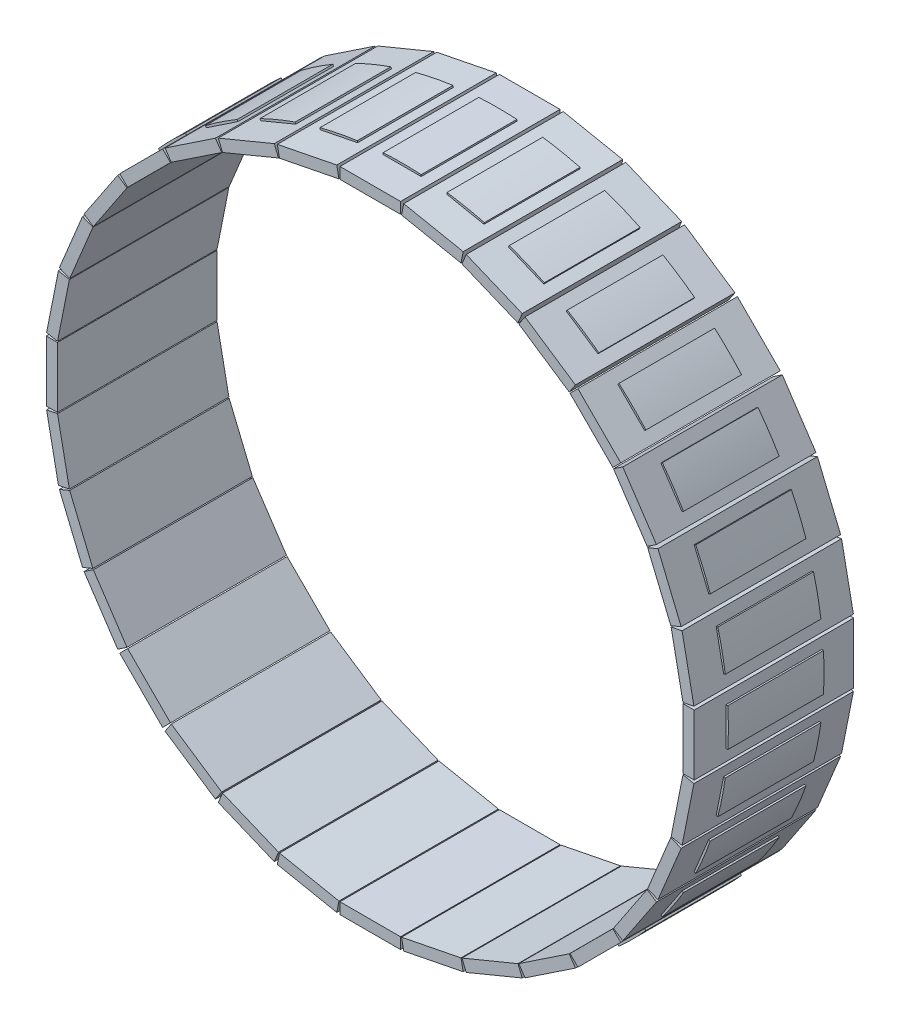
SolidWorks part; units mm, degrees
ref_plane "Спереди" through (0, 0, 0) normal (0, 0, 1) x (1, 0, 0)
ref_plane "Сверху" through (0, 0, 0) normal (0, 1, 0) x (1, 0, 0)
ref_plane "Справа" through (0, 0, 0) normal (1, 0, 0) x (0, 0, -1)
sketch "Эскиз1" plane through (0, 0, 0) normal (0, 0, 1) x (1, 0, 0)
  line L1 (-9.5, 101.5566) -> (9.5, 101.5566)
  line L2 (-9.5, 101.5566) -> (-9.5, 98.0566)
  line L3 (-9.5, 98.0566) -> (9.5, 98.0566)
  line L4 (9.5, 101.5566) -> (9.5, 98.0566)
  line L5 (0, 98.0566) -> (0, 101.5566) construction
  line L6 (-9.5, 99.8066) -> (9.5, 99.8066) construction
  line L130 (10.4953, 101.4586) -> (9.8124, 98.0259)
  line L131 (10.4953, 101.4586) -> (29.1302, 97.7519)
  line L132 (29.1302, 97.7519) -> (28.4474, 94.3191)
  line L133 (9.8124, 98.0259) -> (28.4474, 94.3191)
  line L134 (30.0872, 97.4616) -> (28.7478, 94.228)
  line L135 (30.0872, 97.4616) -> (47.6409, 90.1906)
  line L136 (47.6409, 90.1906) -> (46.3015, 86.957)
  line L137 (28.7478, 94.228) -> (46.3015, 86.957)
  line L138 (48.5229, 89.7192) -> (46.5784, 86.809)
  line L139 (48.5229, 89.7192) -> (64.3208, 79.1633)
  line L140 (64.3208, 79.1633) -> (62.3763, 76.2532)
  line L141 (46.5784, 86.809) -> (62.3763, 76.2532)
  line L142 (65.0939, 78.5289) -> (62.619, 76.054)
  line L143 (65.0939, 78.5289) -> (78.5289, 65.0939)
  line L144 (78.5289, 65.0939) -> (76.054, 62.619)
  line L145 (62.619, 76.054) -> (76.054, 62.619)
  line L146 (79.1633, 64.3208) -> (76.2532, 62.3763)
  line L147 (79.1633, 64.3208) -> (89.7192, 48.5229)
  line L148 (89.7192, 48.5229) -> (86.809, 46.5784)
  line L149 (76.2532, 62.3763) -> (86.809, 46.5784)
  line L150 (90.1906, 47.6409) -> (86.957, 46.3015)
  line L151 (90.1906, 47.6409) -> (97.4616, 30.0872)
  line L152 (97.4616, 30.0872) -> (94.228, 28.7478)
  line L153 (86.957, 46.3015) -> (94.228, 28.7478)
  line L154 (97.7519, 29.1302) -> (94.3191, 28.4474)
  line L155 (97.7519, 29.1302) -> (101.4586, 10.4953)
  line L156 (101.4586, 10.4953) -> (98.0259, 9.8124)
  line L157 (94.3191, 28.4474) -> (98.0259, 9.8124)
  line L158 (101.5566, 9.5) -> (98.0566, 9.5)
  line L159 (101.5566, 9.5) -> (101.5566, -9.5)
  line L160 (101.5566, -9.5) -> (98.0566, -9.5)
  line L161 (98.0566, 9.5) -> (98.0566, -9.5)
  line L162 (101.4586, -10.4953) -> (98.0259, -9.8124)
  line L163 (101.4586, -10.4953) -> (97.7519, -29.1302)
  line L164 (97.7519, -29.1302) -> (94.3191, -28.4474)
  line L165 (98.0259, -9.8124) -> (94.3191, -28.4474)
  line L166 (97.4616, -30.0872) -> (94.228, -28.7478)
  line L167 (97.4616, -30.0872) -> (90.1906, -47.6409)
  line L168 (90.1906, -47.6409) -> (86.957, -46.3015)
  line L169 (94.228, -28.7478) -> (86.957, -46.3015)
  line L170 (89.7192, -48.5229) -> (86.809, -46.5784)
  line L171 (89.7192, -48.5229) -> (79.1633, -64.3208)
  line L172 (79.1633, -64.3208) -> (76.2532, -62.3763)
  line L173 (86.809, -46.5784) -> (76.2532, -62.3763)
  line L174 (78.5289, -65.0939) -> (76.054, -62.619)
  line L175 (78.5289, -65.0939) -> (65.0939, -78.5289)
  line L176 (65.0939, -78.5289) -> (62.619, -76.054)
  line L177 (76.054, -62.619) -> (62.619, -76.054)
  line L178 (64.3208, -79.1633) -> (62.3763, -76.2532)
  line L179 (64.3208, -79.1633) -> (48.5229, -89.7192)
  line L180 (48.5229, -89.7192) -> (46.5784, -86.809)
  line L181 (62.3763, -76.2532) -> (46.5784, -86.809)
  line L182 (47.6409, -90.1906) -> (46.3015, -86.957)
  line L183 (47.6409, -90.1906) -> (30.0872, -97.4616)
  line L184 (30.0872, -97.4616) -> (28.7478, -94.228)
  line L185 (46.3015, -86.957) -> (28.7478, -94.228)
  line L186 (29.1302, -97.7519) -> (28.4474, -94.3191)
  line L187 (29.1302, -97.7519) -> (10.4953, -101.4586)
  line L188 (10.4953, -101.4586) -> (9.8124, -98.0259)
  line L189 (28.4474, -94.3191) -> (9.8124, -98.0259)
  line L190 (9.5, -101.5566) -> (9.5, -98.0566)
  line L191 (9.5, -101.5566) -> (-9.5, -101.5566)
  line L192 (-9.5, -101.5566) -> (-9.5, -98.0566)
  line L193 (9.5, -98.0566) -> (-9.5, -98.0566)
  line L194 (-10.4953, -101.4586) -> (-9.8124, -98.0259)
  line L195 (-10.4953, -101.4586) -> (-29.1302, -97.7519)
  line L196 (-29.1302, -97.7519) -> (-28.4474, -94.3191)
  line L197 (-9.8124, -98.0259) -> (-28.4474, -94.3191)
  line L198 (-30.0872, -97.4616) -> (-28.7478, -94.228)
  line L199 (-30.0872, -97.4616) -> (-47.6409, -90.1906)
  line L200 (-47.6409, -90.1906) -> (-46.3015, -86.957)
  line L201 (-28.7478, -94.228) -> (-46.3015, -86.957)
  line L202 (-48.5229, -89.7192) -> (-46.5784, -86.809)
  line L203 (-48.5229, -89.7192) -> (-64.3208, -79.1633)
  line L204 (-64.3208, -79.1633) -> (-62.3763, -76.2532)
  line L205 (-46.5784, -86.809) -> (-62.3763, -76.2532)
  line L206 (-65.0939, -78.5289) -> (-62.619, -76.054)
  line L207 (-65.0939, -78.5289) -> (-78.5289, -65.0939)
  line L208 (-78.5289, -65.0939) -> (-76.054, -62.619)
  line L209 (-62.619, -76.054) -> (-76.054, -62.619)
  line L210 (-79.1633, -64.3208) -> (-76.2532, -62.3763)
  line L211 (-79.1633, -64.3208) -> (-89.7192, -48.5229)
  line L212 (-89.7192, -48.5229) -> (-86.809, -46.5784)
  line L213 (-76.2532, -62.3763) -> (-86.809, -46.5784)
  line L214 (-90.1906, -47.6409) -> (-86.957, -46.3015)
  line L215 (-90.1906, -47.6409) -> (-97.4616, -30.0872)
  line L216 (-97.4616, -30.0872) -> (-94.228, -28.7478)
  line L217 (-86.957, -46.3015) -> (-94.228, -28.7478)
  line L218 (-97.7519, -29.1302) -> (-94.3191, -28.4474)
  line L219 (-97.7519, -29.1302) -> (-101.4586, -10.4953)
  line L220 (-101.4586, -10.4953) -> (-98.0259, -9.8124)
  line L221 (-94.3191, -28.4474) -> (-98.0259, -9.8124)
  line L222 (-101.5566, -9.5) -> (-98.0566, -9.5)
  line L223 (-101.5566, -9.5) -> (-101.5566, 9.5)
  line L224 (-101.5566, 9.5) -> (-98.0566, 9.5)
  line L225 (-98.0566, -9.5) -> (-98.0566, 9.5)
  line L226 (-101.4586, 10.4953) -> (-98.0259, 9.8124)
  line L227 (-101.4586, 10.4953) -> (-97.7519, 29.1302)
  line L228 (-97.7519, 29.1302) -> (-94.3191, 28.4474)
  line L229 (-98.0259, 9.8124) -> (-94.3191, 28.4474)
  line L230 (-97.4616, 30.0872) -> (-94.228, 28.7478)
  line L231 (-97.4616, 30.0872) -> (-90.1906, 47.6409)
  line L232 (-90.1906, 47.6409) -> (-86.957, 46.3015)
  line L233 (-94.228, 28.7478) -> (-86.957, 46.3015)
  line L234 (-89.7192, 48.5229) -> (-86.809, 46.5784)
  line L235 (-89.7192, 48.5229) -> (-79.1633, 64.3208)
  line L236 (-79.1633, 64.3208) -> (-76.2532, 62.3763)
  line L237 (-86.809, 46.5784) -> (-76.2532, 62.3763)
  line L238 (-78.5289, 65.0939) -> (-76.054, 62.619)
  line L239 (-78.5289, 65.0939) -> (-65.0939, 78.5289)
  line L240 (-65.0939, 78.5289) -> (-62.619, 76.054)
  line L241 (-76.054, 62.619) -> (-62.619, 76.054)
  line L242 (-64.3208, 79.1633) -> (-62.3763, 76.2532)
  line L243 (-64.3208, 79.1633) -> (-48.5229, 89.7192)
  line L244 (-48.5229, 89.7192) -> (-46.5784, 86.809)
  line L245 (-62.3763, 76.2532) -> (-46.5784, 86.809)
  line L246 (-47.6409, 90.1906) -> (-46.3015, 86.957)
  line L247 (-47.6409, 90.1906) -> (-30.0872, 97.4616)
  line L248 (-30.0872, 97.4616) -> (-28.7478, 94.228)
  line L249 (-46.3015, 86.957) -> (-28.7478, 94.228)
  line L250 (-29.1302, 97.7519) -> (-28.4474, 94.3191)
  line L251 (-29.1302, 97.7519) -> (-10.4953, 101.4586)
  line L252 (-10.4953, 101.4586) -> (-9.8124, 98.0259)
  line L253 (-28.4474, 94.3191) -> (-9.8124, 98.0259)
  circle A0 centre (0, 0) radius 102 construction
  point P3 (0, 99.8066)
  point P139 (-0.2511, -0.2511)
  point P140 (0, 0)
  dimension "D1" = 204
  dimension "D2" = 32
  dimension "D3" = 19
extrude "Бобышка-Вытянуть1" add sketch "Эскиз1" along normal blind 50
sketch "Эскиз2" plane through (0, 0, 50) normal (0, 0, 1) x (1, 0, 0)
  line L0 (-5.9657, 102.0758) -> (-5.9657, 100.5331)
  line L1 (-5.9657, 100.5331) -> (5.9657, 100.5331)
  line L2 (5.9657, 100.5331) -> (5.9657, 102.0758)
  line L3 (0, 98.0566) -> (0, 105.2003) construction
  line L4 (-9.5, 98.0566) -> (9.5, 98.0566) construction
  line L5 (25.4641, 97.4375) -> (25.7651, 98.9506)
  line L6 (14.0629, 101.2783) -> (13.762, 99.7652)
  line L7 (13.762, 99.7652) -> (25.4641, 97.4375)
  line L8 (43.9839, 90.5975) -> (44.5743, 92.0228)
  line L9 (33.5511, 96.5887) -> (32.9608, 95.1634)
  line L10 (32.9608, 95.1634) -> (43.9839, 90.5975)
  line L11 (60.8135, 80.2758) -> (61.6706, 81.5586)
  line L12 (51.75, 88.1873) -> (50.8929, 86.9046)
  line L13 (50.8929, 86.9046) -> (60.8135, 80.2758)
  line L14 (75.306, 66.8692) -> (76.3969, 67.9601)
  line L15 (67.9601, 76.3969) -> (66.8692, 75.306)
  line L16 (66.8692, 75.306) -> (75.306, 66.8692)
  line L17 (86.9046, 50.8929) -> (88.1873, 51.75)
  line L18 (81.5586, 61.6706) -> (80.2758, 60.8135)
  line L19 (80.2758, 60.8135) -> (86.9046, 50.8929)
  line L20 (95.1634, 32.9608) -> (96.5887, 33.5511)
  line L21 (92.0228, 44.5743) -> (90.5975, 43.9839)
  line L22 (90.5975, 43.9839) -> (95.1634, 32.9608)
  line L23 (99.7652, 13.762) -> (101.2783, 14.0629)
  line L24 (98.9506, 25.7651) -> (97.4375, 25.4641)
  line L25 (97.4375, 25.4641) -> (99.7652, 13.762)
  line L26 (100.5331, -5.9657) -> (102.0758, -5.9657)
  line L27 (102.0758, 5.9657) -> (100.5331, 5.9657)
  line L28 (100.5331, 5.9657) -> (100.5331, -5.9657)
  line L29 (97.4375, -25.4641) -> (98.9506, -25.7651)
  line L30 (101.2783, -14.0629) -> (99.7652, -13.762)
  line L31 (99.7652, -13.762) -> (97.4375, -25.4641)
  line L32 (90.5975, -43.9839) -> (92.0228, -44.5743)
  line L33 (96.5887, -33.5511) -> (95.1634, -32.9608)
  line L34 (95.1634, -32.9608) -> (90.5975, -43.9839)
  line L35 (80.2758, -60.8135) -> (81.5586, -61.6706)
  line L36 (88.1873, -51.75) -> (86.9046, -50.8929)
  line L37 (86.9046, -50.8929) -> (80.2758, -60.8135)
  line L38 (66.8692, -75.306) -> (67.9601, -76.3969)
  line L39 (76.3969, -67.9601) -> (75.306, -66.8692)
  line L40 (75.306, -66.8692) -> (66.8692, -75.306)
  line L41 (50.8929, -86.9046) -> (51.75, -88.1873)
  line L42 (61.6706, -81.5586) -> (60.8135, -80.2758)
  line L43 (60.8135, -80.2758) -> (50.8929, -86.9046)
  line L44 (32.9608, -95.1634) -> (33.5511, -96.5887)
  line L45 (44.5743, -92.0228) -> (43.9839, -90.5975)
  line L46 (43.9839, -90.5975) -> (32.9608, -95.1634)
  line L47 (13.762, -99.7652) -> (14.0629, -101.2783)
  line L48 (25.7651, -98.9506) -> (25.4641, -97.4375)
  line L49 (25.4641, -97.4375) -> (13.762, -99.7652)
  line L50 (-5.9657, -100.5331) -> (-5.9657, -102.0758)
  line L51 (5.9657, -102.0758) -> (5.9657, -100.5331)
  line L52 (5.9657, -100.5331) -> (-5.9657, -100.5331)
  line L53 (-25.4641, -97.4375) -> (-25.7651, -98.9506)
  line L54 (-14.0629, -101.2783) -> (-13.762, -99.7652)
  line L55 (-13.762, -99.7652) -> (-25.4641, -97.4375)
  line L56 (-43.9839, -90.5975) -> (-44.5743, -92.0228)
  line L57 (-33.5511, -96.5887) -> (-32.9608, -95.1634)
  line L58 (-32.9608, -95.1634) -> (-43.9839, -90.5975)
  line L59 (-60.8135, -80.2758) -> (-61.6706, -81.5586)
  line L60 (-51.75, -88.1873) -> (-50.8929, -86.9046)
  line L61 (-50.8929, -86.9046) -> (-60.8135, -80.2758)
  line L62 (-75.306, -66.8692) -> (-76.3969, -67.9601)
  line L63 (-67.9601, -76.3969) -> (-66.8692, -75.306)
  line L64 (-66.8692, -75.306) -> (-75.306, -66.8692)
  line L65 (-86.9046, -50.8929) -> (-88.1873, -51.75)
  line L66 (-81.5586, -61.6706) -> (-80.2758, -60.8135)
  line L67 (-80.2758, -60.8135) -> (-86.9046, -50.8929)
  line L68 (-95.1634, -32.9608) -> (-96.5887, -33.5511)
  line L69 (-92.0228, -44.5743) -> (-90.5975, -43.9839)
  line L70 (-90.5975, -43.9839) -> (-95.1634, -32.9608)
  line L71 (-99.7652, -13.762) -> (-101.2783, -14.0629)
  line L72 (-98.9506, -25.7651) -> (-97.4375, -25.4641)
  line L73 (-97.4375, -25.4641) -> (-99.7652, -13.762)
  line L74 (-100.5331, 5.9657) -> (-102.0758, 5.9657)
  line L75 (-102.0758, -5.9657) -> (-100.5331, -5.9657)
  line L76 (-100.5331, -5.9657) -> (-100.5331, 5.9657)
  line L77 (-97.4375, 25.4641) -> (-98.9506, 25.7651)
  line L78 (-101.2783, 14.0629) -> (-99.7652, 13.762)
  line L79 (-99.7652, 13.762) -> (-97.4375, 25.4641)
  line L80 (-90.5975, 43.9839) -> (-92.0228, 44.5743)
  line L81 (-96.5887, 33.5511) -> (-95.1634, 32.9608)
  line L82 (-95.1634, 32.9608) -> (-90.5975, 43.9839)
  line L83 (-80.2758, 60.8135) -> (-81.5586, 61.6706)
  line L84 (-88.1873, 51.75) -> (-86.9046, 50.8929)
  line L85 (-86.9046, 50.8929) -> (-80.2758, 60.8135)
  line L86 (-66.8692, 75.306) -> (-67.9601, 76.3969)
  line L87 (-76.3969, 67.9601) -> (-75.306, 66.8692)
  line L88 (-75.306, 66.8692) -> (-66.8692, 75.306)
  line L89 (-50.8929, 86.9046) -> (-51.75, 88.1873)
  line L90 (-61.6706, 81.5586) -> (-60.8135, 80.2758)
  line L91 (-60.8135, 80.2758) -> (-50.8929, 86.9046)
  line L92 (-32.9608, 95.1634) -> (-33.5511, 96.5887)
  line L93 (-44.5743, 92.0228) -> (-43.9839, 90.5975)
  line L94 (-43.9839, 90.5975) -> (-32.9608, 95.1634)
  line L95 (-13.762, 99.7652) -> (-14.0629, 101.2783)
  line L96 (-25.7651, 98.9506) -> (-25.4641, 97.4375)
  line L97 (-25.4641, 97.4375) -> (-13.762, 99.7652)
  circle A0 centre (0, 0) radius 102.25 construction
  arc A1 (-5.9657, 102.0758) -> (5.9657, 102.0758) centre (0, 0) cw
  arc A2 (14.0629, 101.2783) -> (25.7651, 98.9506) centre (0, 0) cw
  arc A3 (33.5511, 96.5887) -> (44.5743, 92.0228) centre (0, 0) cw
  arc A4 (51.75, 88.1873) -> (61.6706, 81.5586) centre (0, 0) cw
  arc A5 (67.9601, 76.3969) -> (76.3969, 67.9601) centre (0, 0) cw
  arc A6 (81.5586, 61.6706) -> (88.1873, 51.75) centre (0, 0) cw
  arc A7 (92.0228, 44.5743) -> (96.5887, 33.5511) centre (0, 0) cw
  arc A8 (98.9506, 25.7651) -> (101.2783, 14.0629) centre (0, 0) cw
  arc A9 (102.0758, 5.9657) -> (102.0758, -5.9657) centre (0, 0) cw
  arc A10 (101.2783, -14.0629) -> (98.9506, -25.7651) centre (0, 0) cw
  arc A11 (96.5887, -33.5511) -> (92.0228, -44.5743) centre (0, 0) cw
  arc A12 (88.1873, -51.75) -> (81.5586, -61.6706) centre (0, 0) cw
  arc A13 (76.3969, -67.9601) -> (67.9601, -76.3969) centre (0, 0) cw
  arc A14 (61.6706, -81.5586) -> (51.75, -88.1873) centre (0, 0) cw
  arc A15 (44.5743, -92.0228) -> (33.5511, -96.5887) centre (0, 0) cw
  arc A16 (25.7651, -98.9506) -> (14.0629, -101.2783) centre (0, 0) cw
  arc A17 (5.9657, -102.0758) -> (-5.9657, -102.0758) centre (0, 0) cw
  arc A18 (-14.0629, -101.2783) -> (-25.7651, -98.9506) centre (0, 0) cw
  arc A19 (-33.5511, -96.5887) -> (-44.5743, -92.0228) centre (0, 0) cw
  arc A20 (-51.75, -88.1873) -> (-61.6706, -81.5586) centre (0, 0) cw
  arc A21 (-67.9601, -76.3969) -> (-76.3969, -67.9601) centre (0, 0) cw
  arc A22 (-81.5586, -61.6706) -> (-88.1873, -51.75) centre (0, 0) cw
  arc A23 (-92.0228, -44.5743) -> (-96.5887, -33.5511) centre (0, 0) cw
  arc A24 (-98.9506, -25.7651) -> (-101.2783, -14.0629) centre (0, 0) cw
  arc A25 (-102.0758, -5.9657) -> (-102.0758, 5.9657) centre (0, 0) cw
  arc A26 (-101.2783, 14.0629) -> (-98.9506, 25.7651) centre (0, 0) cw
  arc A27 (-96.5887, 33.5511) -> (-92.0228, 44.5743) centre (0, 0) cw
  arc A28 (-88.1873, 51.75) -> (-81.5586, 61.6706) centre (0, 0) cw
  arc A29 (-76.3969, 67.9601) -> (-67.9601, 76.3969) centre (0, 0) cw
  arc A30 (-61.6706, 81.5586) -> (-51.75, 88.1873) centre (0, 0) cw
  arc A31 (-44.5743, 92.0228) -> (-33.5511, 96.5887) centre (0, 0) cw
  arc A32 (-25.7651, 98.9506) -> (-14.0629, 101.2783) centre (0, 0) cw
  point P12 (0, 100.5331)
  point P140 (0, 0)
  dimension "D1" = 204.5
  dimension "D2" = 32
extrude "Бобышка-Вытянуть2" add sketch "Эскиз2" against normal blind 30 from offset 10
